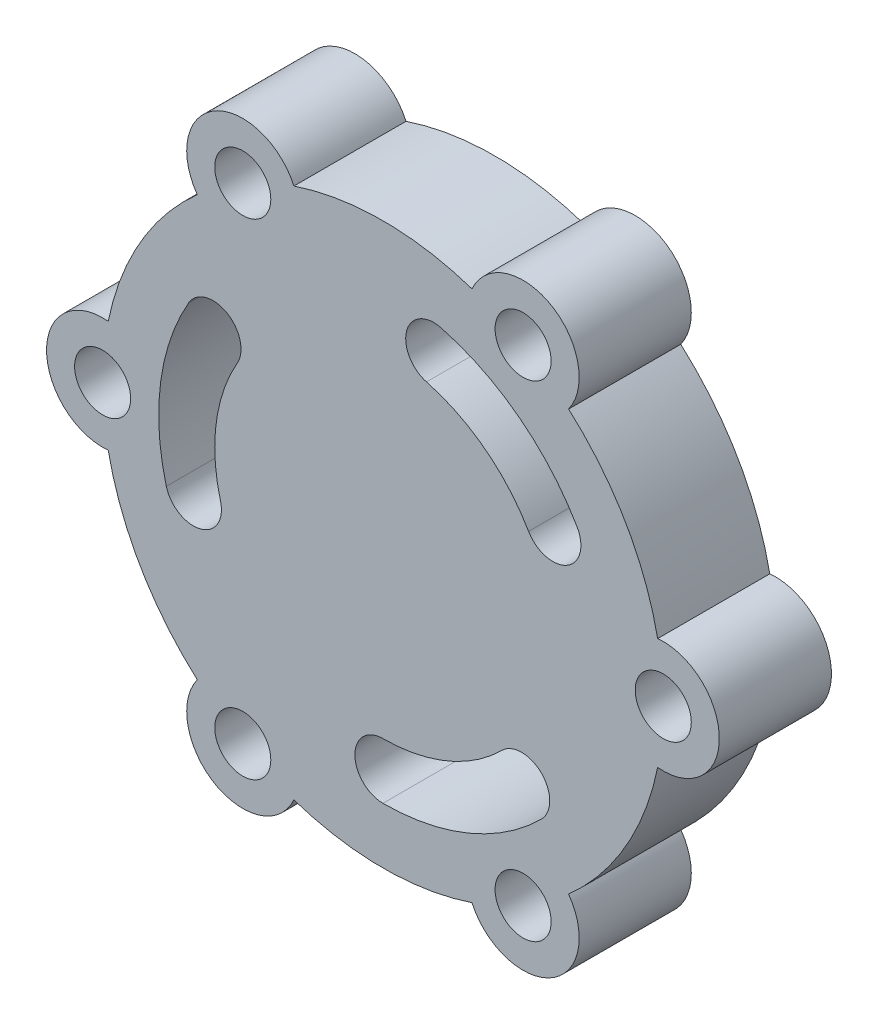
SolidWorks part; units mm, degrees
ref_plane "Front Plane" through (0, 0, 0) normal (0, 0, 1) x (1, 0, 0)
ref_plane "Top Plane" through (0, 0, 0) normal (0, 1, 0) x (1, 0, 0)
ref_plane "Right Plane" through (0, 0, 0) normal (1, 0, 0) x (0, 0, -1)
sketch "Sketch1" plane through (0, 0, 0) normal (0, 0, 1) x (1, 0, 0)
  line L0 (70, 70) -> (100.3109, 87.5) construction
  line L1 (70, 70) -> (70, 35) construction
  line L2 (70, 70) -> (120, 70) construction
  line L3 (70, 70) -> (95, 26.6987) construction
  arc A0 (119, 79.9499) -> (103.1168, 107.4603) centre (70, 70) ccw
  arc A1 (119, 60.0501) -> (119, 79.9499) centre (120, 70) ccw
  arc A2 (85.8832, 22.5898) -> (103.1168, 32.5397) centre (95, 26.6987) ccw
  arc A3 (36.8832, 32.5397) -> (54.1168, 22.5898) centre (45, 26.6987) ccw
  arc A4 (21, 79.9499) -> (21, 60.0501) centre (20, 70) ccw
  arc A5 (54.1168, 117.4102) -> (36.8832, 107.4603) centre (45, 113.3013) ccw
  arc A6 (103.1168, 107.4603) -> (85.8832, 117.4102) centre (95, 113.3013) ccw
  arc A7 (21, 60.0501) -> (36.8832, 32.5397) centre (70, 70) ccw
  arc A8 (36.8832, 107.4603) -> (21, 79.9499) centre (70, 70) ccw
  arc A9 (85.8832, 117.4102) -> (54.1168, 117.4102) centre (70, 70) ccw
  arc A10 (54.1168, 22.5898) -> (85.8832, 22.5898) centre (70, 70) ccw
  arc A11 (103.1168, 32.5397) -> (119, 60.0501) centre (70, 70) ccw
  arc A12 (100.3109, 87.5) -> (79.0587, 103.8074) centre (70, 70) ccw construction
  arc A13 (104.641, 90) -> (80.3528, 108.637) centre (70, 70) ccw
  arc A14 (95.9808, 85) -> (77.7646, 98.9778) centre (70, 70) ccw
  arc A15 (95.9808, 85) -> (104.641, 90) centre (100.3109, 87.5) ccw
  arc A16 (80.3528, 108.637) -> (77.7646, 98.9778) centre (79.0587, 103.8074) ccw
  arc A17 (70, 35) -> (94.7487, 45.2513) centre (70, 70) ccw construction
  arc A18 (70, 30) -> (98.2843, 41.7157) centre (70, 70) ccw
  arc A19 (70, 40) -> (91.2132, 48.7868) centre (70, 70) ccw
  arc A20 (70, 40) -> (70, 30) centre (70, 35) ccw
  arc A21 (98.2843, 41.7157) -> (91.2132, 48.7868) centre (94.7487, 45.2513) ccw
  arc A22 (39.6891, 87.5) -> (36.1926, 60.9413) centre (70, 70) ccw construction
  arc A23 (35.359, 90) -> (31.363, 59.6472) centre (70, 70) ccw
  arc A24 (44.0192, 85) -> (41.0222, 62.2354) centre (70, 70) ccw
  arc A25 (44.0192, 85) -> (35.359, 90) centre (39.6891, 87.5) ccw
  arc A26 (31.363, 59.6472) -> (41.0222, 62.2354) centre (36.1926, 60.9413) ccw
  circle A27 centre (120, 70) radius 5
  circle A28 centre (95, 26.6987) radius 5
  circle A29 centre (45, 26.6987) radius 5
  circle A30 centre (20, 70) radius 5
  circle A31 centre (45, 113.3013) radius 5
  circle A32 centre (95, 113.3013) radius 5
  point P21 (91.3067, 97.7674)
  point P32 (83.3939, 37.6642)
  point P41 (35.2994, 74.5684)
  dimension "D1" = 6
  dimension "D4" = 10
  dimension "D5" = 50
  dimension "D7" = 5
  dimension "D9" = 35
  dimension "D10" = 10
  dimension "D2" = 70
  dimension "D3" = 70
  dimension "D6" = 45
  dimension "D8" = 30
  dimension "D12" = 75
  dimension "D13" = 6
  dimension "D14" = 60
  dimension "D11" = 3
extrude "Boss-Extrude1" add sketch "Sketch1" along normal blind 20
